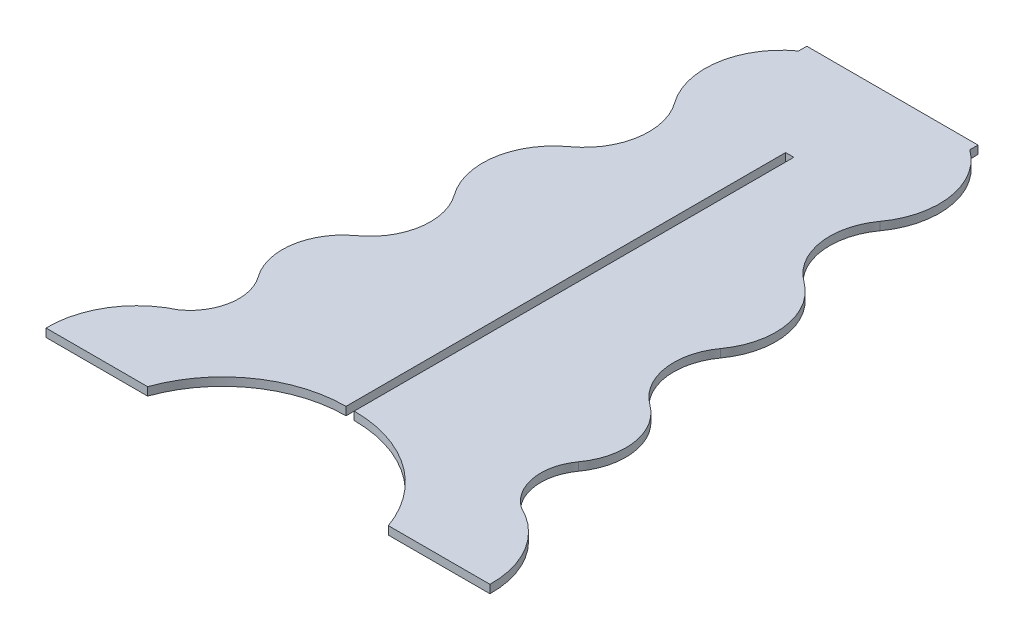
SolidWorks part; units mm, degrees
ref_plane "Front Plane" through (0, 0, 0) normal (0, 0, 1) x (1, 0, 0)
ref_plane "Top Plane" through (0, 0, 0) normal (0, 1, 0) x (1, 0, 0)
ref_plane "Right Plane" through (0, 0, 0) normal (1, 0, 0) x (0, 0, -1)
sketch "Sketch1" plane through (0, 0, 0) normal (0, 1, 0) x (1, 0, 0)
  line L1 (0, 0) -> (0, 780) construction
  line L2 (250, 0) -> (250, -240) construction
  line L4 (125, 780) -> (250, 0) construction
  line L5 (6, 0) -> (6, 642)
  line L6 (125, 780) -> (125, 792)
  line L7 (125, 792) -> (-125, 792)
  line L8 (-125, 780) -> (-125, 792)
  line L9 (6, 642) -> (-6, 642)
  line L10 (-6, 0) -> (-6, 642)
  line L11 (250, -240) -> (-250, -240) construction
  line L12 (324.1909, -120) -> (175.8091, -120)
  line L14 (-324.1909, -120) -> (-175.8091, -120)
  arc A0 (-125, 780) -> (-149.9935, 624.0406) centre (-59.5171, 689.5236) ccw
  arc A1 (-149.9935, 624.0406) -> (-171.2041, 491.6862) centre (-226.776, 568.4687) cw
  arc A2 (-171.2041, 491.6862) -> (-194.4407, 346.69) centre (-110.3243, 407.5698) ccw
  arc A3 (-194.4407, 346.69) -> (-214.1603, 223.6394) centre (-265.8258, 295.0245) cw
  arc A4 (-214.1603, 223.6394) -> (-234.0009, 99.8344) centre (-162.1781, 151.8166) ccw
  arc A5 (-234.0009, 99.8344) -> (-250, 0) centre (-291.9176, 57.9167) cw
  arc A6 (234.0009, 99.8344) -> (250, 0) centre (291.9176, 57.9167) ccw
  arc A7 (214.1603, 223.6394) -> (234.0009, 99.8344) centre (162.1781, 151.8166) cw
  arc A8 (194.4407, 346.69) -> (214.1603, 223.6394) centre (265.8258, 295.0245) ccw
  arc A9 (171.2041, 491.6862) -> (194.4407, 346.69) centre (110.3243, 407.5698) cw
  arc A10 (149.9935, 624.0406) -> (171.2041, 491.6862) centre (226.776, 568.4687) ccw
  arc A11 (125, 780) -> (149.9935, 624.0406) centre (59.5171, 689.5236) cw
  arc A12 (250, 0) -> (324.1909, -120) centre (193.9976, -117.5585) cw
  arc A13 (175.8091, -120) -> (6, 0) centre (6, -180.1463) ccw
  arc A14 (-175.8091, -120) -> (-6, 0) centre (-6, -180.1463) cw
  arc A15 (-250, 0) -> (-324.1909, -120) centre (-193.9976, -117.5585) ccw
  point P4 (0, 0)
  point P8 (0, 780)
  point P42 (250, -120)
  dimension "D1" = 500
  dimension "D2" = 780
  dimension "D3" = 250
  dimension "D4" = 12
  dimension "D5" = 6
  dimension "D6" = 12
  dimension "D7" = 150
  dimension "D8" = 120
extrude "Boss-Extrude1" add sketch "Sketch1" along normal blind 12
